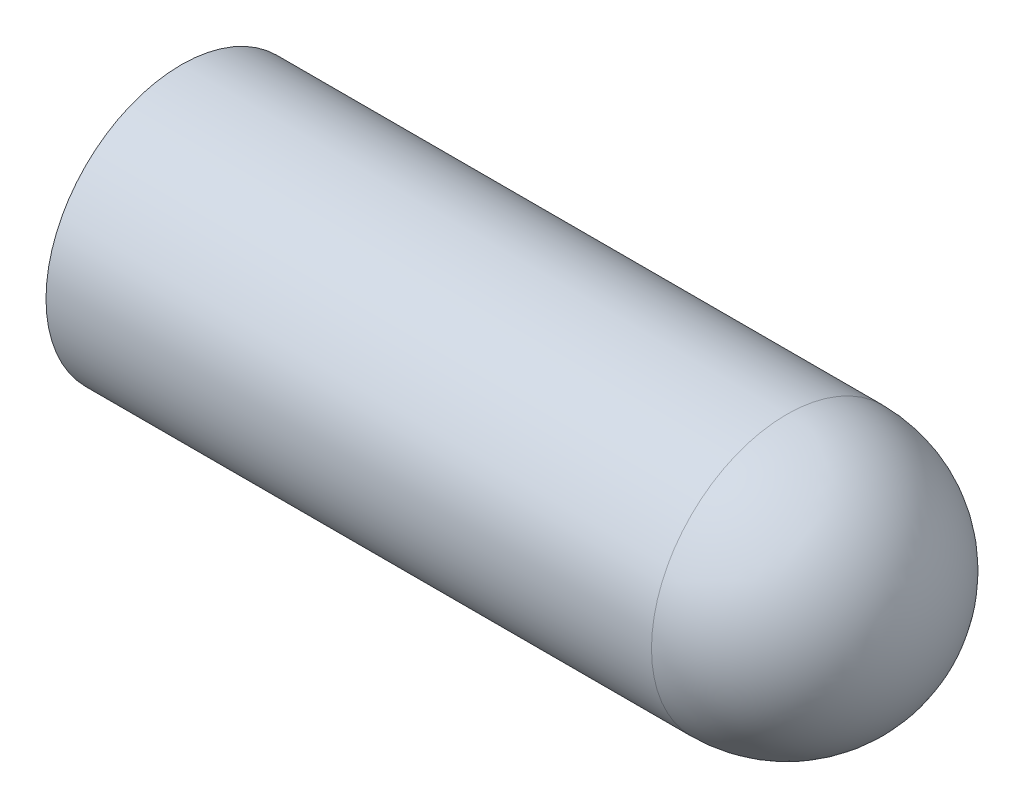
SolidWorks part; units mm, degrees
ref_plane "Front Plane" through (0, 0, 0) normal (0, 0, 1) x (1, 0, 0)
ref_plane "Top Plane" through (0, 0, 0) normal (0, 1, 0) x (1, 0, 0)
ref_plane "Right Plane" through (0, 0, 0) normal (1, 0, 0) x (0, 0, -1)
sketch "Sketch2" plane through (0, 0, 0) normal (0, 0, 1) x (1, 0, 0)
  line L0 (21.05, 0) -> (-14.55, 0)
  line L2 (-14.55, 0) -> (-14.55, 6.5)
  line L3 (-14.55, 6.5) -> (14.55, 6.5)
  line L5 (0, 0) -> (14.55, 6.5) construction
  line L6 (-14.55, 6.5) -> (0, 0) construction
  arc A0 (14.55, 6.5) -> (21.05, 0) centre (14.55, 0) cw
  point P0 (0, 0)
  dimension "D1" = 6.5
  dimension "D2" = 29.1
revolve "Revolve6" add sketch "Sketch2" angle 360 about L0
shell "Shell1" thickness 0.6
